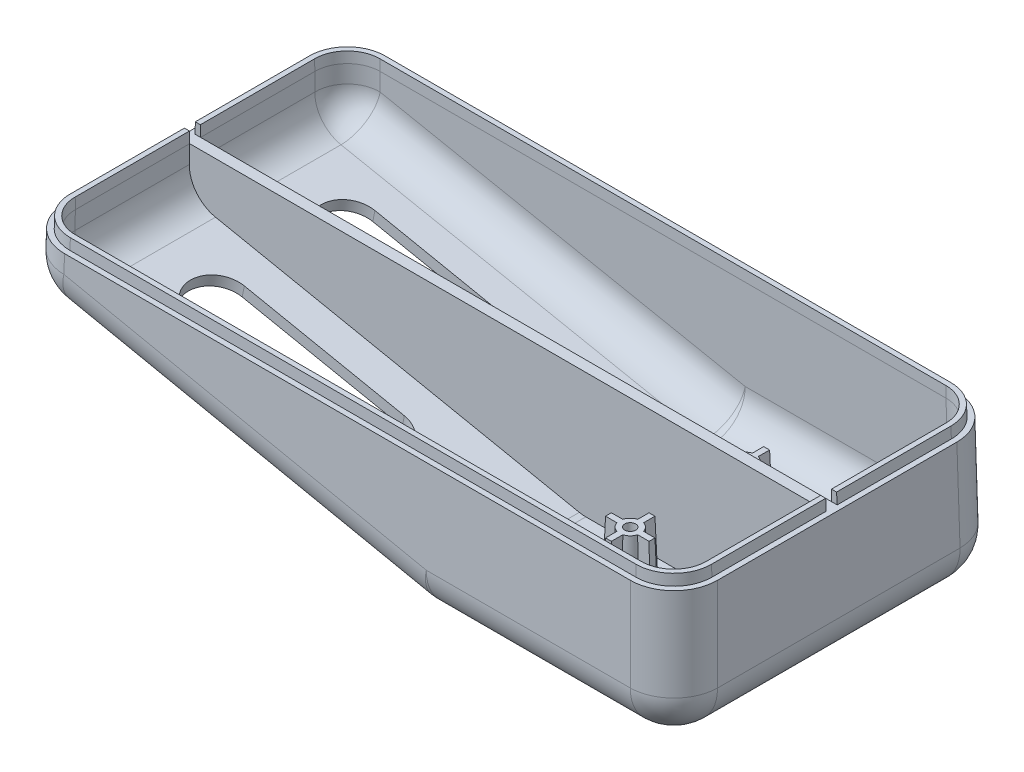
SolidWorks part; units mm, degrees
ref_plane "Front Plane" through (0, 0, 0) normal (0, 0, 1) x (1, 0, 0)
ref_plane "Top Plane" through (0, 0, 0) normal (0, 1, 0) x (1, 0, 0)
ref_plane "Right Plane" through (0, 0, 0) normal (1, 0, 0) x (0, 0, -1)
sketch "Sketch1" plane through (0, 0, 0) normal (0, 0, 1) x (1, 0, 0)
  line L0 (0, 0) -> (120, 0)
  line L1 (120, 0) -> (120, -25)
  line L2 (120, -25) -> (74, -25)
  line L3 (74, -25) -> (0, -10)
  line L4 (0, -10) -> (0, 0)
  dimension "D1" = 120
  dimension "D2" = 25
  dimension "D3" = 10
  dimension "D4" = 46
extrude "Extrude1" add sketch "Sketch1" along normal mid plane 60
draft "Draft1" type of draft neutral plane draft angle 1 faces to draft 4 parameters "D1"=1
fillet "Fillet2" radius 8 11 edges at (-0.087, -4.9824, -30.087) (36.913, -17.4824, -30.3052) (97.2182, -25, -30.4364) (120.2182, -12.5, -30.2182) (36.913, -17.4824, 30.3052) (97.2182, -25, 30.4364) (120.2182, -12.5, 30.2182) (120.4364, -25, 0) (74, -25, 0) (-0.1739, -9.9647, 0) (-0.087, -4.9824, 30.087)
shell "Shell2" thickness 2
sketch "Sketch2" plane through (-1.5497, -7.6452, 0) normal (0.1987, 0.9801, 0) x (0.9801, -0.1987, 0)
  line L0 (13.4252, 0) -> (69.2046, 0) construction
  line L1 (20, 17) -> (50, 17)
  line L2 (20, -17) -> (50, -17)
  line L3 (50, 7) -> (20, 7)
  line L4 (50, -7) -> (20, -7)
  line L6 (0, -22.0012) -> (0, 22.0012) construction
  line L8 (109.7688, 30) -> (7.8393, 30) construction
  arc A0 (50, 17) -> (50, 7) centre (50, 12) cw
  arc A1 (50, -17) -> (50, -7) centre (50, -12) ccw
  arc A2 (20, 7) -> (20, 17) centre (20, 12) cw
  arc A3 (20, -7) -> (20, -17) centre (20, -12) ccw
  dimension "D1" = 5
  dimension "D2" = 24
  dimension "D3" = 30
  dimension "D4" = 20
  dimension "D5" = 18
extrude "Extrude2" cut sketch "Sketch2" against normal up to next
sketch3d "3DSketch1"
  line L1 (74, -25, -30.4364) -> (120.4364, -25, -30.4364) construction
  line L2 (120.4364, -25, 30.4364) -> (120.4364, -25, -30.4364) construction
  point P0 (92.5079, -23, -10.5366)
  dimension "D1" = 20
  dimension "D2" = 28
other "Mounting Boss1" parameters "BossDiam"=4.8, "BossHeight"=12, "FinHeight"=12, "FinLength"=4, "FinWidth"=1.5, "InsDiam"=2, "InsHeight"=5, "BossDraft"=2, "FinDraft"=1, "InsDraft"=1
mirror "Mirror1" about plane through (0, 0, 0) normal (0, 0, 1) of "Mounting Boss1"
sketch "Sketch3" plane through (0, 0, 0) normal (0, 1, 0) x (1, 0, 0)
  line L0 (0, 0) -> (120, 0)
  line L1 (120, -22.0012) -> (120, 22.0012) construction
rib "Rib1" sketch "Sketch3" sketch "Sketch3" thickness 2 extrusion direction normal to sketch draft on no parameters "D1"=2
other "Lip1" parameters "LipHeight"=2, "LipWidth"=1, "LipDraftAngle"=2, "D4"=0, "D5"=0, "D6"=2, "D7"=1, "D8"=2, "D9"=0
